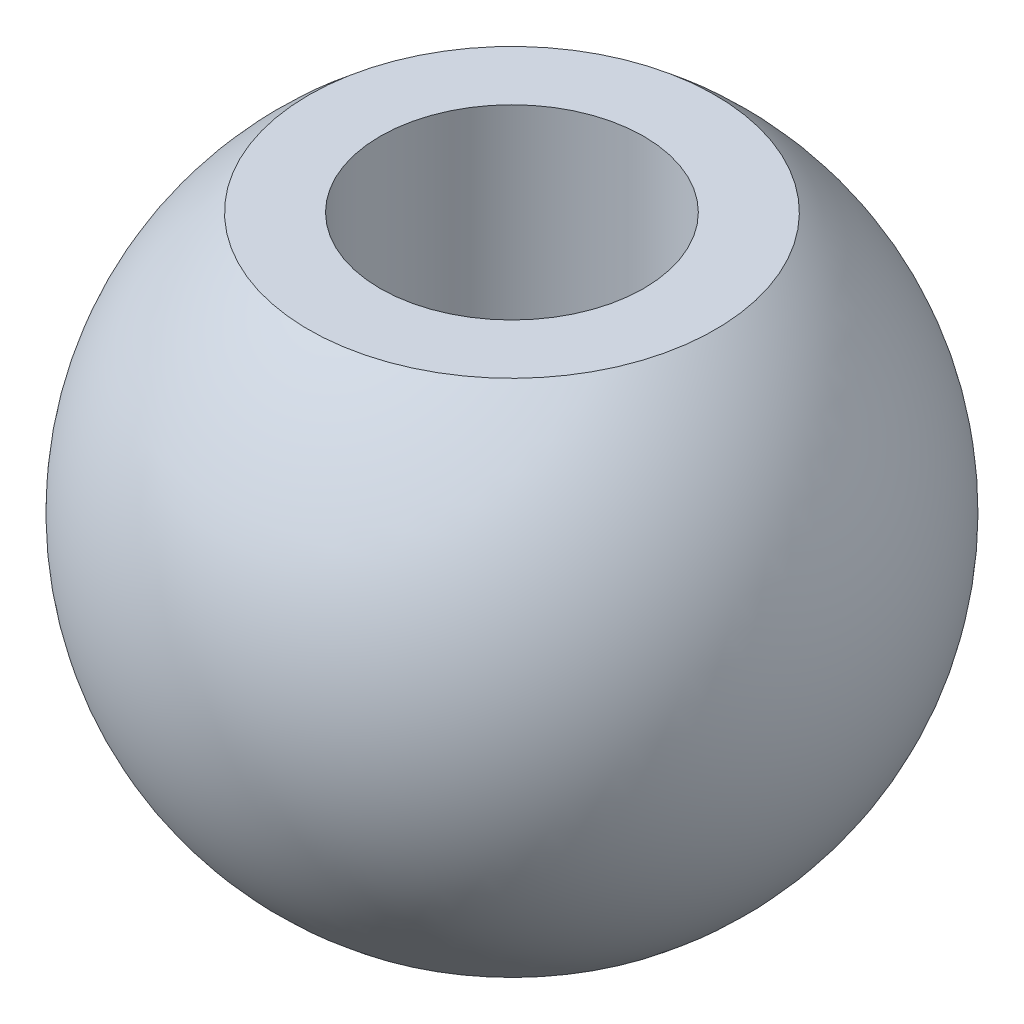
SolidWorks part; units mm, degrees
ref_plane "Front Plane" through (0, 0, 0) normal (0, 0, 1) x (1, 0, 0)
ref_plane "Top Plane" through (0, 0, 0) normal (0, 1, 0) x (1, 0, 0)
ref_plane "Right Plane" through (0, 0, 0) normal (1, 0, 0) x (0, 0, -1)
sketch "Sketch1" plane through (0, 0, 0) normal (0, 0, 1) x (1, 0, 0)
  line L0 (0, 0) -> (0, 42.8842) construction
  line L1 (0, 0) -> (-1.5875, 0) construction
  line L2 (-1.5875, 3.1242) -> (-2.4475, 3.1242)
  line L3 (-1.5875, 3.1242) -> (-1.5875, -3.1242)
  line L4 (-1.5875, -3.1242) -> (-2.4475, -3.1242)
  arc A0 (-2.4475, 3.1242) -> (-2.4475, -3.1242) centre (0, 0) ccw
  dimension "D1" = 3.9688
  dimension "D2" = 3.175
  dimension "D3" = 6.2484
revolve "Revolve1" add sketch "Sketch1" angle 360 about L0
